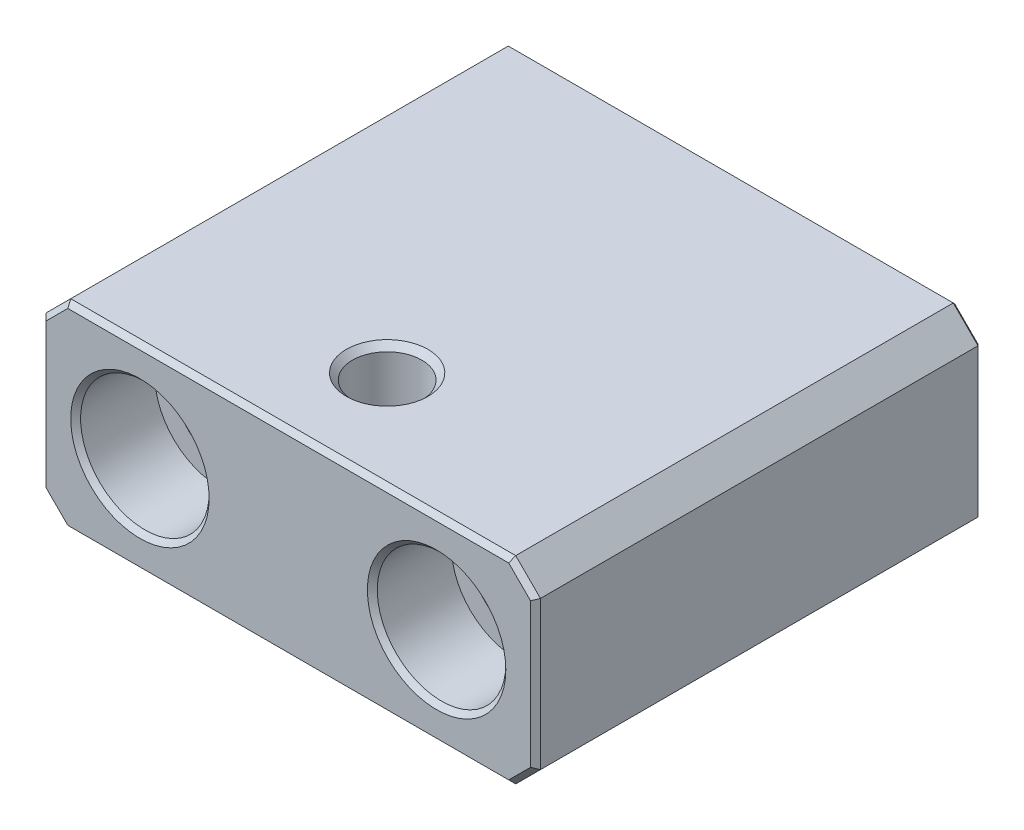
SolidWorks part; units mm, degrees
ref_plane "Plan de face" through (0, 0, 0) normal (0, 0, 1) x (1, 0, 0)
ref_plane "Plan de dessus" through (0, 0, 0) normal (0, 1, 0) x (1, 0, 0)
ref_plane "Plan de droite" through (0, 0, 0) normal (1, 0, 0) x (0, 0, -1)
sketch "Esquisse1" plane through (0, 0, 0) normal (0, 0, 1) x (1, 0, 0)
  line L0 (-50, 40) -> (-50, 0)
  line L1 (-50, 0) -> (50, 0)
  line L2 (50, 0) -> (50, 40)
  line L3 (50, 40) -> (-50, 40)
  dimension "D1" = 100
  dimension "D2" = 40
extrude "Volume" add sketch "Esquisse1" along normal blind 90
sketch "Position lamage 1 - Vis CHc M16" plane through (0, 0, 90) normal (0, 0, 1) x (1, 0, 0)
  line L0 (-50, 0) -> (50, 0) construction
  line L1 (-50, 40) -> (-50, 0) construction
  line L2 (50, 0) -> (50, 40) construction
  point P0 (-30, 20)
  point P6 (30, 20)
  dimension "D1" = 20
  dimension "D2" = 20
  dimension "D3" = 20
  dimension "D4" = 60
hole_wizard "Chambrage pour vis à tête hexagonale M164" positions "Esquisse3D4" profile "Esquisse8" counterbore size "M16" standard "ISO"
sketch3d "Esquisse3D4"
  point P0 (-30, 20, 90)
  point P6 (30, 20, 90)
sketch "Esquisse8" plane through (-30, 20, 90) normal (1, 0, 0) x (0, -1, 0)
  line L0 (0, 0) -> (0, 90)
  line L1 (0, 90) -> (8.75, 90)
  line L3 (8.75, 90) -> (8.75, 16)
  line L4 (8.75, 16) -> (13, 16)
  line L5 (13, 16) -> (13, 0)
  line L7 (13, 0) -> (0, 0)
  line L11 (0, -6.35) -> (0, 107.95) construction
  dimension "Diamètre du perçage jusqu'au prochain" = 17.5
  dimension "Profondeur du perçage jusqu'au prochain" = 90
  dimension "Diamètre du chambrage" = 26
  dimension "Profondeur du chambrage" = 16
sketch "Position taraudage M16" plane through (0, 0, 0) normal (0, -1, 0) x (1, 0, 0)
  line L1 (-50, 0) -> (50, 0) construction
  point P0 (0, 70)
  dimension "D1" = 70
hole_wizard "Trou taraudé M16" positions "Esquisse11" profile "Esquisse10" tap size "M16" standard "DIN"
sketch "Esquisse11" plane through (0, 0, 0) normal (0, -1, 0) x (1, 0, 0)
  point P0 (0, 70)
sketch "Esquisse10" plane through (0, 0, 70) normal (1, 0, 0) x (0, 0, -1)
  line L0 (0, 0) -> (0, 40)
  line L1 (0, 40) -> (8.25, 40)
  line L2 (7, 38.75) -> (7, 1.25)
  line L3 (7, 1.25) -> (8.25, 0)
  line L5 (8.25, 0) -> (0, 0)
  line L6 (-7, 1.25) -> (-8.25, 0) construction
  line L7 (8.25, 40) -> (7, 38.75)
  line L8 (-8.25, 40) -> (-7, 38.75) construction
  line L11 (0, -6.35) -> (0, 107.95) construction
  dimension "Diamètre du trou pour taraudage jusqu'au prochain" = 14
  dimension "Profondeur du trou pour taraudage jusqu'au prochain" = 40
  dimension "Diamètre du fraisage entrant" = 16.5
  dimension "Angle du fraisage entrant" = 90
  dimension "Diamètre du fraisage débouchant" = 16.5
  dimension "Angle du fraisage débouchant" = 90
chamfer "Chanfrein3" distance 5 angle 45 4 edges at (50, 40, 45) (50, 0, 45) (-50, 40, 45) (-50, 0, 45)
chamfer "Chanfrein 1mm" distance 1 angle 45 10 edges at (50, 20, 90) (0, 0, 90) (-50, 20, 90) (0, 40, 90) (43, 20, 90) (-17, 20, 90) (47.5, 2.5, 90) (-47.5, 2.5, 90) (-47.5, 37.5, 90) (47.5, 37.5, 90)
chamfer "Chanfrein 0.5mm" distance 0.5 angle 45 10 edges at (-50, 20, 0) (0, 0, 0) (50, 20, 0) (0, 40, 0) (38.75, 20, 0) (-21.25, 20, 0) (-47.5, 37.5, 0) (-47.5, 2.5, 0) (47.5, 2.5, 0) (47.5, 37.5, 0)
